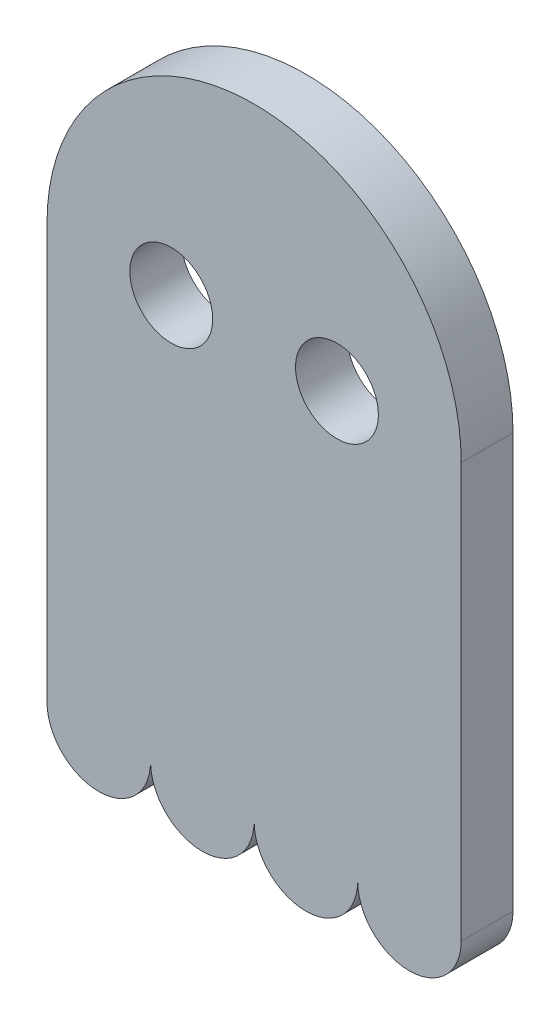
SolidWorks part; units mm, degrees
ref_plane "Front Plane" through (0, 0, 0) normal (0, 0, 1) x (1, 0, 0)
ref_plane "Top Plane" through (0, 0, 0) normal (0, 1, 0) x (1, 0, 0)
ref_plane "Right Plane" through (0, 0, 0) normal (1, 0, 0) x (0, 0, -1)
sketch "Sketch1" plane through (0, 0, 0) normal (0, 0, 1) x (1, 0, 0)
  line L0 (0, 0) -> (0, 60) construction
  line L1 (20, 0) -> (20, 40)
  line L2 (20, 40) -> (0, 40) construction
  line L3 (20, 0) -> (0, 0) construction
  line L4 (-20, 0) -> (-20, 40)
  arc A0 (20, 40) -> (-20, 40) centre (0, 40) ccw
  circle A1 centre (8, 40) radius 4
  arc A2 (10, 0) -> (20, 0) centre (15, 0) ccw
  arc A3 (0, 0) -> (10, 0) centre (5, 0) ccw
  arc A4 (0, 0) -> (-10, 0) centre (-5, 0) cw
  arc A5 (-10, 0) -> (-20, 0) centre (-15, 0) cw
  circle A6 centre (-8, 40) radius 4
  dimension "D3" = 10
  dimension "D4" = 8
  dimension "D5" = 8
  dimension "D1" = 40
extrude "Extrude1" add sketch "Sketch1" along normal blind 5
